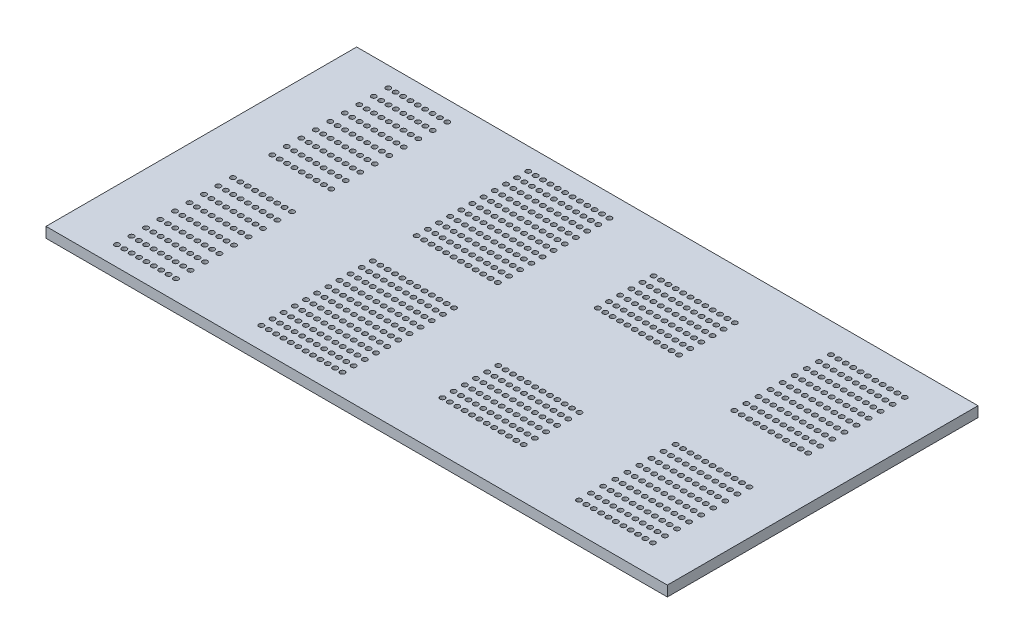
SolidWorks part; units mm, degrees
ref_plane "Plan de face" through (0, 0, 0) normal (0, 0, 1) x (1, 0, 0)
ref_plane "Plan de dessus" through (0, 0, 0) normal (0, 1, 0) x (1, 0, 0)
ref_plane "Plan de droite" through (0, 0, 0) normal (1, 0, 0) x (0, 0, -1)
sketch "Esquisse2" plane through (0, 0, 0) normal (0, 1, 0) x (1, 0, 0)
  line L1 (-60, -15) -> (60, -15)
  line L2 (-60, -15) -> (-60, 15)
  line L3 (-60, 15) -> (60, 15)
  line L4 (60, -15) -> (60, 15)
  line L5 (-60, -15) -> (60, 15) construction
  line L6 (-60, 15) -> (60, -15) construction
  point P0 (0, 0)
  dimension "D1" = 30
  dimension "D2" = 120
extrude "Boss.-Extru.1" add sketch "Esquisse2" along normal blind 2 contours L3 L4 L1 L2
sketch "Cavités" plane through (0, 0, 0) normal (0, 1, 0) x (1, 0, 0)
  line L0 (-60, -15) -> (60, -15) construction
  line L1 (-58.4, 15) -> (-30.4, 15) construction
  line L2 (-58.4, 15) -> (-58.4, -15) construction
  line L3 (-58.4, -15) -> (-30.4, -15) construction
  line L4 (-30.4, 15) -> (-30.4, -15) construction
  line L5 (-60, 15) -> (60, 15) construction
  line L6 (-28.8, 15) -> (-0.8, 15) construction
  line L7 (-28.8, 15) -> (-28.8, -15) construction
  line L8 (-28.8, -15) -> (-0.8, -15) construction
  line L9 (-0.8, 15) -> (-0.8, -15) construction
  line L10 (-30.4, 15) -> (-28.8, 15) construction
  line L11 (0.8, 15) -> (28.8, 15) construction
  line L12 (0.8, 15) -> (0.8, -15) construction
  line L13 (0.8, -15) -> (28.8, -15) construction
  line L14 (28.8, 15) -> (28.8, -15) construction
  line L15 (30.4, 15) -> (58.4, 15) construction
  line L16 (30.4, 15) -> (30.4, -15) construction
  line L17 (30.4, -15) -> (58.4, -15) construction
  line L18 (58.4, 15) -> (58.4, -15) construction
  line L19 (-0.8, 15) -> (0.8, 15) construction
  line L20 (28.8, 15) -> (30.4, 15) construction
  line L21 (-60, 15) -> (-58.4, 15) construction
  line L22 (58.4, 15) -> (60, 15) construction
  dimension "D1" = 28
  dimension "D2" = 1.6
sketch "Esquisse7" plane through (0, 2, 0) normal (0, 1, 0) x (1, 0, 0)
  line L0 (-58.4, 0) -> (-50.096, 0) construction
  line L1 (-50.096, 11.2) -> (-38.704, 11.2) construction
  line L2 (-50.096, 11.2) -> (-50.096, -11.2) construction
  line L3 (-50.096, -11.2) -> (-38.704, -11.2) construction
  line L4 (-38.704, 11.2) -> (-38.704, -11.2) construction
  line L5 (-58.4, 15) -> (-58.4, -15) construction
  line L6 (-38.704, 0) -> (-30.4, 0) construction
  line L7 (-30.4, 15) -> (-30.4, -15) construction
  dimension "D1" = 11.392
  dimension "D2" = 22.4
sketch "Esquisse8" plane through (0, 2, 0) normal (0, 1, 0) x (1, 0, 0)
  circle A0 centre (-50.096, 11.2) radius 0.475
  dimension "D1" = 0.95
extrude "Enlèv. mat.-Extru.3" cut sketch "Esquisse8" against normal up to next
pattern_linear "Répétition linéaire4" count 9 spacing 1.424 along (1, 0, 0) count 9 spacing 2.8 along (0, 0, 1) of "Enlèv. mat.-Extru.3"
sketch "Esquisse9" plane through (0, 2, 0) normal (0, 1, 0) x (1, 0, 0)
  line L0 (-28.8, 0) -> (-22.6375, 0) construction
  line L1 (-22.6375, 10.77) -> (-6.9625, 10.77) construction
  line L2 (-22.6375, 10.77) -> (-22.6375, -10.77) construction
  line L3 (-22.6375, -10.77) -> (-6.9625, -10.77) construction
  line L4 (-6.9625, 10.77) -> (-6.9625, -10.77) construction
  line L5 (-28.8, 15) -> (-28.8, -15) construction
  line L6 (-6.9625, 0) -> (-0.8, 0) construction
  line L7 (-0.8, 15) -> (-0.8, -15) construction
  dimension "D1" = 15.675
  dimension "D2" = 21.54
sketch "Esquisse10" plane through (0, 2, 0) normal (0, 1, 0) x (1, 0, 0)
  circle A0 centre (-22.6375, 10.77) radius 0.475
  dimension "D1" = 0.95
extrude "Enlèv. mat.-Extru.4" cut sketch "Esquisse10" against normal up to next
pattern_linear "Répétition linéaire5" count 12 spacing 1.425 along (1, 0, 0) count 11 spacing 2.154 along (0, 0, 1) of "Enlèv. mat.-Extru.4"
sketch "Esquisse11" plane through (0, 2, 0) normal (0, 1, 0) x (1, 0, 0)
  line L0 (0.8, 0) -> (6.9625, 0) construction
  line L1 (6.9625, 5.385) -> (22.6375, 5.385) construction
  line L2 (6.9625, 5.385) -> (6.9625, -5.385) construction
  line L3 (6.9625, -5.385) -> (22.6375, -5.385) construction
  line L4 (22.6375, 5.385) -> (22.6375, -5.385) construction
  line L5 (0.8, 15) -> (0.8, -15) construction
  line L6 (22.6375, 0) -> (28.8, 0) construction
  line L7 (28.8, 15) -> (28.8, -15) construction
  dimension "D1" = 15.675
  dimension "D2" = 10.77
sketch "Esquisse12" plane through (0, 2, 0) normal (0, 1, 0) x (1, 0, 0)
  circle A0 centre (6.9625, 5.385) radius 0.475
  dimension "D1" = 0.95
extrude "Enlèv. mat.-Extru.5" cut sketch "Esquisse12" against normal up to next
pattern_linear "Répétition linéaire6" count 12 spacing 1.425 along (1, 0, 0) count 6 spacing 2.154 along (0, 0, 1) of "Enlèv. mat.-Extru.5"
sketch "Esquisse13" plane through (0, 2, 0) normal (0, 1, 0) x (1, 0, 0)
  line L0 (30.4, 0) -> (37.275, 0) construction
  line L1 (37.275, 9.332) -> (51.525, 9.332) construction
  line L2 (37.275, 9.332) -> (37.275, -9.332) construction
  line L3 (37.275, -9.332) -> (51.525, -9.332) construction
  line L4 (51.525, 9.332) -> (51.525, -9.332) construction
  line L5 (30.4, 15) -> (30.4, -15) construction
  line L6 (51.525, 0) -> (58.4, 0) construction
  line L7 (58.4, 15) -> (58.4, -15) construction
  dimension "D1" = 18.664
  dimension "D2" = 14.25
sketch "Esquisse14" plane through (0, 2, 0) normal (0, 1, 0) x (1, 0, 0)
  circle A0 centre (37.275, 9.332) radius 0.475
  dimension "D1" = 0.95
extrude "Enlèv. mat.-Extru.6" cut sketch "Esquisse14" against normal up to next
pattern_linear "Répétition linéaire7" count 11 spacing 1.425 along (1, 0, 0) count 9 spacing 2.333 along (0, 0, 1) of "Enlèv. mat.-Extru.6"
mirror "Symétrie1" about plane through (-60, 2, 15) normal (0, 0, -1)
